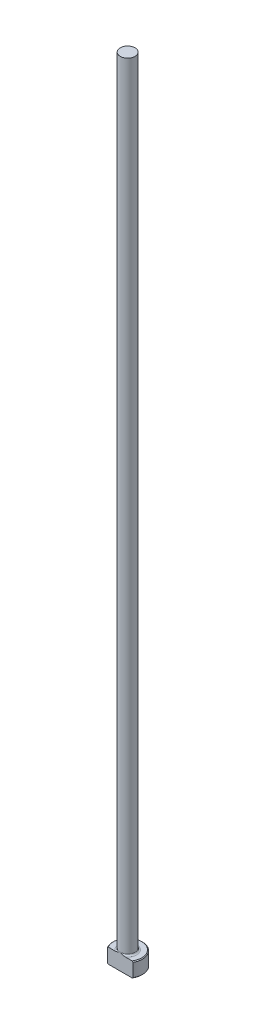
SolidWorks part; units mm, degrees
ref_plane "Front Plane" through (0, 0, 0) normal (0, 0, 1) x (1, 0, 0)
ref_plane "Top Plane" through (0, 0, 0) normal (0, 1, 0) x (1, 0, 0)
ref_plane "Right Plane" through (0, 0, 0) normal (1, 0, 0) x (0, 0, -1)
sketch "Sketch1" plane through (0, 0, 0) normal (0, 0, 1) x (1, 0, 0)
  line L0 (0, 259.9588) -> (0, -15.1925) construction
  line L1 (0, 0) -> (-4.7625, 0)
  line L2 (-4.7625, 0) -> (-4.7625, 4.7498)
  line L3 (-4.7625, 4.7498) -> (-2.3812, 4.7498)
  line L4 (-2.3812, 4.7498) -> (-2.3812, 254)
  line L5 (-2.3812, 254) -> (0, 254)
  line L6 (0, 254) -> (0, 0)
  dimension "L" = 254
  dimension "H" = 9.525
  dimension "T" = 4.7498
  dimension "D" = 4.7625
revolve "Revolve1" add sketch "Sketch1" angle 360 about L0
chamfer "Chamfer1" distance 0.254 angle 45 2 edges at (0, 4.7498, 4.7625) (0, 0, 4.7625)
fillet "Fillet1" radius 0.508 1 edges at (0, 4.7498, 2.3812)
sketch "Sketch2" plane through (0, 0, 0) normal (0, -1, 0) x (1, 0, 0)
  line L0 (-4.1244, 2.3812) -> (4.1244, 2.3812)
  arc A0 (4.1244, 2.3812) -> (-4.1244, 2.3812) centre (0, 0) ccw
  circle A1 centre (0, 0) radius 4.7625 construction
  circle A3 centre (0, 0) radius 2.3812 construction
extrude "KEY" cut sketch "Sketch2" against normal through all
sketch "Pocket Sketch" plane through (0, 0, 0) normal (0, 0, 1) x (1, 0, 0)
  line L0 (-5.1594, 0) -> (-5.1594, 4.7752)
  line L1 (-5.1594, 4.7752) -> (-3.3417, 4.7752)
  line L2 (-2.5797, 5.5372) -> (-2.5797, 22.225)
  line L3 (-2.5797, 22.225) -> (0, 22.225)
  line L4 (0, 22.225) -> (0, 0)
  line L5 (0, 0) -> (-5.1594, 0)
  line L6 (0, 12.6104) -> (0, -2.4989) construction
  line L7 (-4.7625, 4.4958) -> (-4.7625, 0.254) construction
  line L8 (4.5085, 4.7498) -> (-4.5085, 4.7498) construction
  line L9 (-2.3812, 254) -> (-2.3812, 5.2578) construction
  line L10 (-3.3417, 4.7752) -> (-2.5797, 5.5372)
  point P3 (-2.5797, 4.7752)
  dimension "D1" = 10.3187
  dimension "D2" = 0.3969
  dimension "D3" = 0.0254
  dimension "D4" = 0.1984
  dimension "D5" = 5.1594
  dimension "D6" = 22.225
